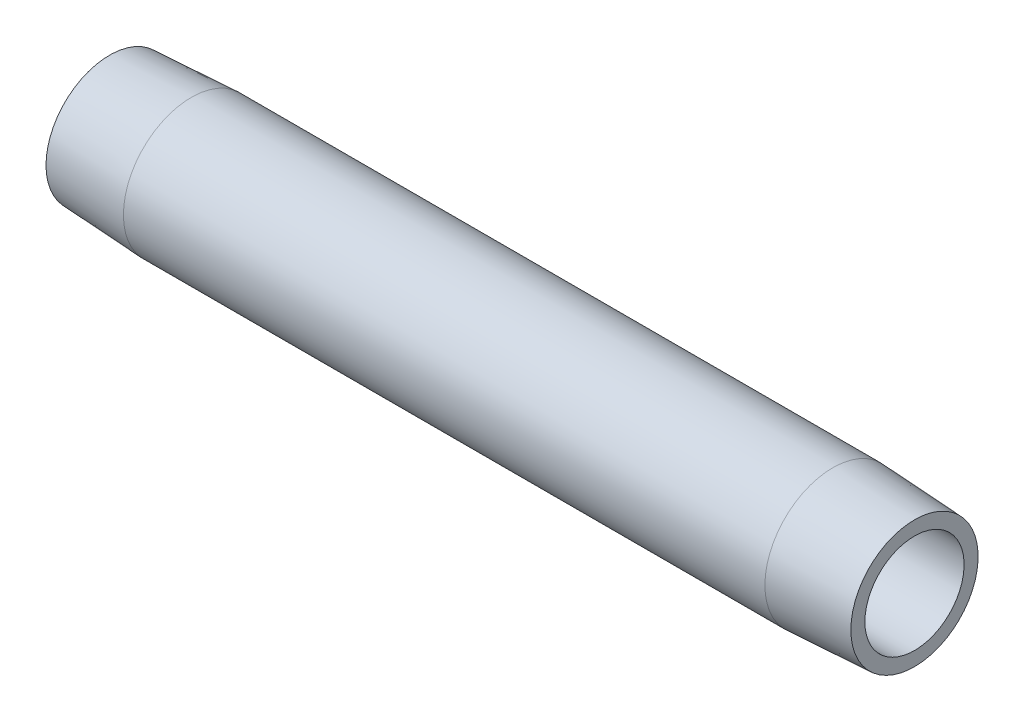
SolidWorks part; units mm, degrees
ref_plane "Front Plane" through (0, 0, 0) normal (0, 0, 1) x (1, 0, 0)
ref_plane "Top Plane" through (0, 0, 0) normal (0, 1, 0) x (1, 0, 0)
ref_plane "Right Plane" through (0, 0, 0) normal (1, 0, 0) x (0, 0, -1)
sketch "Sketch1" plane through (0, 0, 0) normal (0, 0, 1) x (1, 0, 0)
  line L5 (101.6, 6.2611) -> (0, 6.2611)
  line L6 (91.2876, 8.5725) -> (10.3124, 8.5725)
  line L7 (10.3124, 8.5725) -> (0, 8.0321)
  line L8 (101.6, 8.0321) -> (91.2876, 8.5725)
  line L9 (101.6, 6.2611) -> (101.6, 8.0321)
  line L10 (0, 6.2611) -> (0, 8.0321)
  line L11 (0, 0) -> (50000, 0) construction
  line L12 (0, -55) -> (0, 55) construction
  dimension "D1" = 12.5222
  dimension "D2" = 17.145
  dimension "D3" = 3
  dimension "D4" = 3
  dimension "D5" = 101.6
  dimension "D6" = 10.3124
  dimension "D7" = 10.3124
revolve "Revolve1" add sketch "Sketch1" angle 360 about L11
